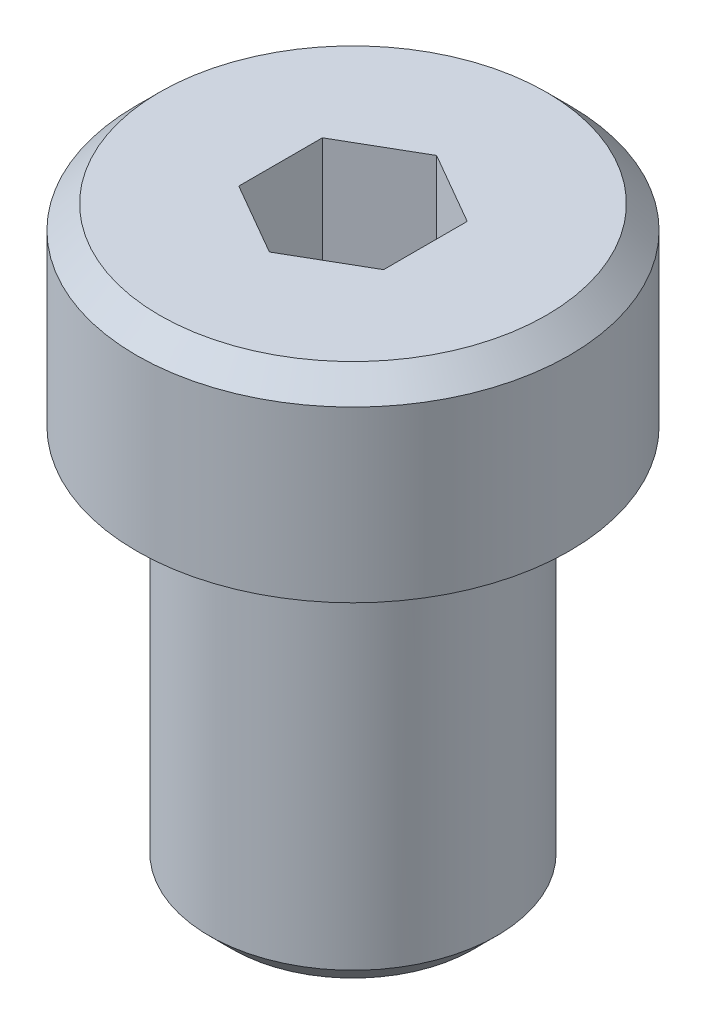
SolidWorks part; units mm, degrees
ref_plane "Plane1" through (0, 0, 0) normal (0, 0, 1) x (1, 0, 0)
ref_plane "Plane2" through (0, 0, 0) normal (0, 1, 0) x (1, 0, 0)
ref_plane "Plane3" through (0, 0, 0) normal (1, 0, 0) x (0, 0, -1)
sketch "Sketch2" plane through (0, 0, 0) normal (0, 0, 1) x (1, 0, 0)
  line L0 (0, 0) -> (7.1374, 0)
  line L1 (7.1374, 0) -> (7.1374, 5.588)
  line L2 (7.1374, 5.588) -> (6.3754, 6.35)
  line L3 (6.3754, 6.35) -> (0, 6.35)
  line L4 (0, 6.35) -> (0, 0)
  line L5 (0, 0) -> (0, 98.4216) construction
  dimension "D1" = 14.2748
  dimension "D2" = 6.35
  dimension "D3" = 45
  dimension "D4" = 0.762
revolve "Base-Revolve" add sketch "Sketch2" angle 360 about L5
sketch "Sketch3" plane through (0, 0, 0) normal (0, 0, 1) x (1, 0, 0)
  line L0 (0, 0) -> (0, 7.8563) construction
  line L1 (0, -12.954) -> (4.7371, -12.954)
  line L6 (4.7371, -12.954) -> (4.7371, 0)
  line L9 (4.7371, 0) -> (0, 0)
  line L10 (0, 0) -> (0, -12.954)
  line L11 (-7.1374, 0) -> (7.1374, 0) construction
  dimension "D1" = 12.954
  dimension "D4" = 9.4742
revolve "Boss-Revolve1" add sketch "Sketch3" angle 360 about L0
ref_plane "Plane4" through (0, 6.35, 0) normal (0, 1, 0) x (-1, 0, 0)
sketch "Sketch4" plane through (0, 6.35, 0) normal (0, 1, 0) x (-1, 0, 0)
  line L0 (2.3876, 1.3785) -> (0, 2.757)
  line L1 (0, 2.757) -> (-2.3876, 1.3785)
  line L2 (-2.3876, 1.3785) -> (-2.3876, -1.3785)
  line L3 (-2.3876, -1.3785) -> (0, -2.757)
  line L4 (0, -2.757) -> (2.3876, -1.3785)
  line L5 (2.3876, -1.3785) -> (2.3876, 1.3785)
extrude "Cut-Extrude1" cut sketch "Sketch4" against normal blind 3.5814
chamfer "Chamfer1" distance 0.762 angle 45 1 edges at (0, -12.954, -4.7371)
